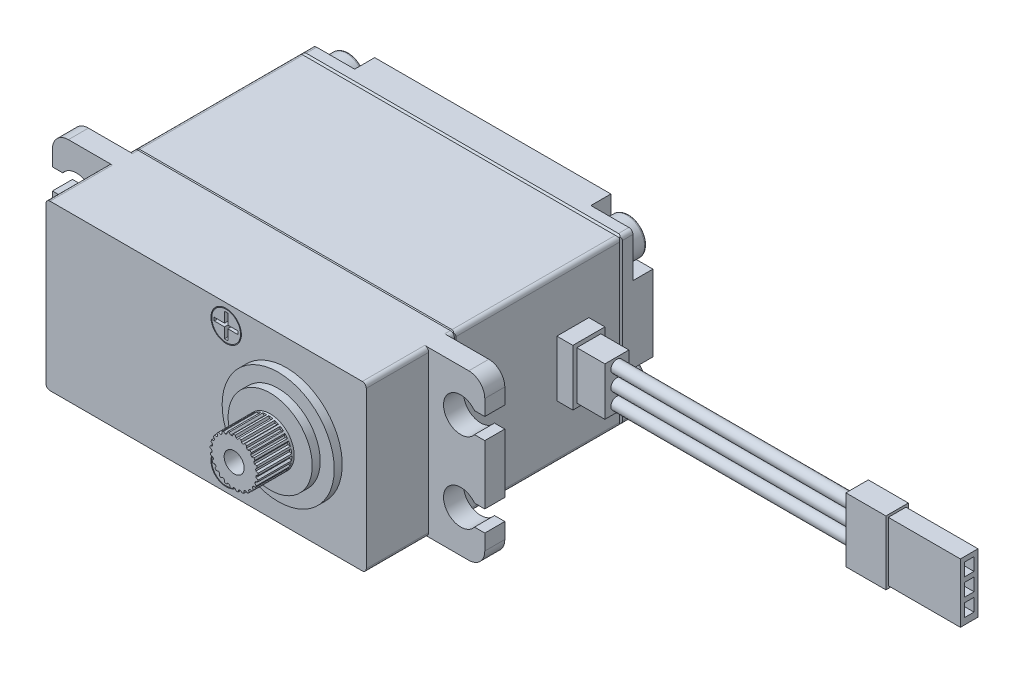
SolidWorks part; units mm, degrees
ref_plane "前视基准面" through (0, 0, 0) normal (0, 0, 1) x (1, 0, 0)
ref_plane "上视基准面" through (0, 0, 0) normal (0, 1, 0) x (1, 0, 0)
ref_plane "右视基准面" through (0, 0, 0) normal (1, 0, 0) x (0, 0, -1)
sketch "草图1" plane through (0, 0, 0) normal (0, 0, 1) x (1, 0, 0)
  line L1 (-20, 10.25) -> (20, 10.25)
  line L2 (-20, 10.25) -> (-20, -10.25)
  line L3 (-20, -10.25) -> (20, -10.25)
  line L4 (20, 10.25) -> (20, -10.25)
  dimension "D1" = 10.25
  dimension "D2" = 20.5
  dimension "D3" = 20
  dimension "D4" = 40
extrude "凸台-拉伸1" add sketch "草图1" along normal blind 4
chamfer "倒角1" distance 0.2 angle 45 4 edges at (0, 10.25, 4) (20, 0, 4) (0, -10.25, 4) (-20, 0, 4)
sketch "草图2" plane through (0, 0, 4) normal (0, 0, 1) x (1, 0, 0)
  line L0 (20, 10.25) -> (20, -10.25) construction
  line L1 (20, -10.25) -> (-20, -10.25) construction
  line L2 (-20, -10.25) -> (-20, 10.25) construction
  line L3 (-20, 10.25) -> (20, 10.25) construction
  line L4 (20, 10.25) -> (20, -10.25)
  line L5 (20, -10.25) -> (-20, -10.25)
  line L6 (-20, -10.25) -> (-20, 10.25)
  line L7 (-20, 10.25) -> (20, 10.25)
extrude "凸台-拉伸2" add sketch "草图2" along normal blind 20.8
chamfer "倒角4" distance 0.2 angle 45 4 edges at (-20, 0, 4) (0, 10.25, 4) (20, 0, 4) (0, -10.25, 4)
chamfer "倒角5" distance 0.2 angle 45 4 edges at (20, 0, 24.8) (0, -10.25, 24.8) (-20, 0, 24.8) (0, 10.25, 24.8)
sketch "草图3" plane through (0, 0, 24.8) normal (0, 0, 1) x (1, 0, 0)
  line L0 (20, 10.25) -> (20, -10.25) construction
  line L1 (20, -10.25) -> (-20, -10.25) construction
  line L2 (-20, -10.25) -> (-20, 10.25) construction
  line L3 (-20, 10.25) -> (20, 10.25) construction
  line L4 (20, 10.25) -> (20, -10.25)
  line L5 (20, -10.25) -> (-20, -10.25)
  line L6 (-20, -10.25) -> (-20, 10.25)
  line L7 (-20, 10.25) -> (20, 10.25)
extrude "凸台-拉伸3" add sketch "草图3" along normal blind 11
sketch "草图4" plane through (0, 0, 35.8) normal (0, 0, 1) x (1, 0, 0)
  line L0 (20, -10.25) -> (20, 10.25) construction
  circle A0 centre (10, 0) radius 7
  dimension "D1" = 10
  dimension "D2" = 14
extrude "凸台-拉伸4" add sketch "草图4" along normal blind 2
sketch "草图5" plane through (0, 0, 37.8) normal (0, 0, 1) x (1, 0, 0)
  circle A0 centre (10, 0) radius 3
  dimension "D1" = 6
extrude "凸台-拉伸5" add sketch "草图5" along normal blind 4.5
ref_plane "基准面1" through (0, 0, 23) normal (0, 0, 1) x (1, 0, 0)
sketch "草图11" plane through (0, 0, 42.3) normal (0, 0, 1) x (1, 0, 0)
  circle A0 centre (10, 0) radius 1.25
  dimension "D1" = 2.5
extrude "切除-拉伸7" cut sketch "草图11" against normal blind 6
sketch "草图12" plane through (0, 0, 42.3) normal (0, 0, 1) x (1, 0, 0)
  line L1 (9.76, 2.7395) -> (9.88, 2.9976)
  line L2 (10.24, 2.7395) -> (10.12, 2.9976)
  line L3 (10.9137, 2.5938) -> (10.8617, 2.8736)
  line L4 (10.4488, 2.7131) -> (10.6292, 2.9333)
  line L5 (11.5301, 2.285) -> (11.5493, 2.569)
  line L6 (11.1095, 2.5163) -> (11.3389, 2.6846)
  line L7 (12.0503, 1.8327) -> (12.1395, 2.103)
  line L8 (11.7004, 2.1613) -> (11.9645, 2.2673)
  line L9 (12.4416, 1.2653) -> (12.5953, 1.5049)
  line L10 (12.1844, 1.6705) -> (12.4667, 1.7075)
  line L11 (12.6796, 0.6183) -> (12.888, 0.8122)
  line L12 (12.5313, 1.0748) -> (12.8138, 1.0404)
  line L13 (12.7492, -0.0675) -> (12.9992, 0.0685)
  line L14 (12.719, 0.4115) -> (12.9841, 0.308)
  line L15 (12.646, -0.7491) -> (12.922, -0.6796)
  line L16 (12.736, -0.2776) -> (12.967, -0.4438)
  line L17 (12.3766, -1.3836) -> (12.6612, -1.3849)
  line L18 (12.581, -0.9493) -> (12.7634, -1.1677)
  line L19 (11.9578, -1.9312) -> (12.2332, -2.0032)
  line L20 (12.2638, -1.5613) -> (12.3862, -1.8183)
  line L21 (11.4161, -2.3574) -> (11.6649, -2.4956)
  line L22 (11.8044, -2.0752) -> (11.859, -2.3546)
  line L23 (10.7853, -2.6355) -> (10.9919, -2.8313)
  line L24 (11.2316, -2.4588) -> (11.2151, -2.7429)
  line L25 (10.1052, -2.748) -> (10.2566, -2.989)
  line L26 (10.5815, -2.6878) -> (10.4948, -2.9589)
  line L27 (9.4185, -2.6878) -> (9.5052, -2.9589)
  line L28 (9.8948, -2.748) -> (9.7434, -2.989)
  line L29 (8.7684, -2.4588) -> (8.7849, -2.7429)
  line L30 (9.2147, -2.6355) -> (9.0081, -2.8313)
  line L31 (8.1956, -2.0752) -> (8.141, -2.3546)
  line L32 (8.5839, -2.3574) -> (8.3351, -2.4956)
  line L33 (7.7362, -1.5613) -> (7.6138, -1.8183)
  line L34 (8.0422, -1.9312) -> (7.7668, -2.0032)
  line L35 (7.419, -0.9493) -> (7.2366, -1.1677)
  line L36 (7.6234, -1.3836) -> (7.3388, -1.3849)
  line L37 (7.264, -0.2776) -> (7.033, -0.4438)
  line L38 (7.354, -0.7491) -> (7.078, -0.6796)
  line L39 (7.281, 0.4115) -> (7.0159, 0.308)
  line L40 (7.2508, -0.0675) -> (7.0008, 0.0685)
  line L41 (7.4687, 1.0748) -> (7.1862, 1.0404)
  line L42 (7.3204, 0.6183) -> (7.112, 0.8122)
  line L43 (7.8156, 1.6705) -> (7.5333, 1.7075)
  line L44 (7.5584, 1.2653) -> (7.4047, 1.5049)
  line L45 (8.2996, 2.1613) -> (8.0355, 2.2673)
  line L46 (7.9497, 1.8327) -> (7.8605, 2.103)
  line L47 (8.8905, 2.5163) -> (8.6611, 2.6846)
  line L48 (8.4699, 2.285) -> (8.4507, 2.569)
  line L49 (9.5512, 2.7131) -> (9.3708, 2.9333)
  line L50 (9.0863, 2.5938) -> (9.1383, 2.8736)
  arc A0 (9.76, 2.7395) -> (9.5512, 2.7131) centre (10, 0) ccw
  arc A1 (9.0863, 2.5938) -> (8.8905, 2.5163) centre (10, 0) ccw
  circle A2 centre (10, 0) radius 3 construction
  arc A3 (9.88, 2.9976) -> (9.3708, 2.9333) centre (10, 0) ccw
  arc A4 (9.1383, 2.8736) -> (8.6611, 2.6846) centre (10, 0) ccw
  arc A5 (8.4699, 2.285) -> (8.2996, 2.1613) centre (10, 0) ccw
  arc A6 (8.4507, 2.569) -> (8.0355, 2.2673) centre (10, 0) ccw
  arc A7 (7.9497, 1.8327) -> (7.8156, 1.6705) centre (10, 0) ccw
  arc A8 (7.8605, 2.103) -> (7.5333, 1.7075) centre (10, 0) ccw
  arc A9 (7.5584, 1.2653) -> (7.4687, 1.0748) centre (10, 0) ccw
  arc A10 (7.4047, 1.5049) -> (7.1862, 1.0404) centre (10, 0) ccw
  arc A11 (7.3204, 0.6183) -> (7.281, 0.4115) centre (10, 0) ccw
  arc A12 (7.112, 0.8122) -> (7.0159, 0.308) centre (10, 0) ccw
  arc A13 (7.2508, -0.0675) -> (7.264, -0.2776) centre (10, 0) ccw
  arc A14 (7.0008, 0.0685) -> (7.033, -0.4438) centre (10, 0) ccw
  arc A15 (7.354, -0.7491) -> (7.419, -0.9493) centre (10, 0) ccw
  arc A16 (7.078, -0.6796) -> (7.2366, -1.1677) centre (10, 0) ccw
  arc A17 (7.3388, -1.3849) -> (7.6138, -1.8183) centre (10, 0) ccw
  arc A18 (7.6234, -1.3836) -> (7.7362, -1.5613) centre (10, 0) ccw
  arc A19 (8.0422, -1.9312) -> (8.1956, -2.0752) centre (10, 0) ccw
  arc A20 (7.7668, -2.0032) -> (8.141, -2.3546) centre (10, 0) ccw
  arc A21 (8.5839, -2.3574) -> (8.7684, -2.4588) centre (10, 0) ccw
  arc A22 (8.3351, -2.4956) -> (8.7849, -2.7429) centre (10, 0) ccw
  arc A23 (9.2147, -2.6355) -> (9.4185, -2.6878) centre (10, 0) ccw
  arc A24 (9.0081, -2.8313) -> (9.5052, -2.9589) centre (10, 0) ccw
  arc A25 (9.8948, -2.748) -> (10.1052, -2.748) centre (10, 0) ccw
  arc A26 (9.7434, -2.989) -> (10.2566, -2.989) centre (10, 0) ccw
  arc A27 (10.5815, -2.6878) -> (10.7853, -2.6355) centre (10, 0) ccw
  arc A28 (10.4948, -2.9589) -> (10.9919, -2.8313) centre (10, 0) ccw
  arc A29 (11.2316, -2.4588) -> (11.4161, -2.3574) centre (10, 0) ccw
  arc A30 (11.2151, -2.7429) -> (11.6649, -2.4956) centre (10, 0) ccw
  arc A31 (11.8044, -2.0752) -> (11.9578, -1.9312) centre (10, 0) ccw
  arc A32 (11.859, -2.3546) -> (12.2332, -2.0032) centre (10, 0) ccw
  arc A33 (12.3862, -1.8183) -> (12.6612, -1.3849) centre (10, 0) ccw
  arc A34 (12.2638, -1.5613) -> (12.3766, -1.3836) centre (10, 0) ccw
  arc A35 (12.7634, -1.1677) -> (12.922, -0.6796) centre (10, 0) ccw
  arc A36 (12.581, -0.9493) -> (12.646, -0.7491) centre (10, 0) ccw
  arc A37 (12.967, -0.4438) -> (12.9992, 0.0685) centre (10, 0) ccw
  arc A38 (12.736, -0.2776) -> (12.7492, -0.0675) centre (10, 0) ccw
  arc A39 (12.9841, 0.308) -> (12.888, 0.8122) centre (10, 0) ccw
  arc A40 (12.719, 0.4115) -> (12.6796, 0.6183) centre (10, 0) ccw
  arc A41 (12.5313, 1.0748) -> (12.4416, 1.2653) centre (10, 0) ccw
  arc A42 (12.8138, 1.0404) -> (12.5953, 1.5049) centre (10, 0) ccw
  arc A43 (12.1844, 1.6705) -> (12.0503, 1.8327) centre (10, 0) ccw
  arc A44 (12.4667, 1.7075) -> (12.1395, 2.103) centre (10, 0) ccw
  arc A45 (11.7004, 2.1613) -> (11.5301, 2.285) centre (10, 0) ccw
  arc A46 (11.9645, 2.2673) -> (11.5493, 2.569) centre (10, 0) ccw
  arc A47 (11.1095, 2.5163) -> (10.9137, 2.5938) centre (10, 0) ccw
  arc A48 (11.3389, 2.6846) -> (10.8617, 2.8736) centre (10, 0) ccw
  arc A49 (10.4488, 2.7131) -> (10.24, 2.7395) centre (10, 0) ccw
  arc A50 (10.6292, 2.9333) -> (10.12, 2.9976) centre (10, 0) ccw
  point P111 (10, 0)
  dimension "D1" = 5.5
  dimension "D4" = 25
extrude "切除-拉伸8" cut sketch "草图12" against normal blind 4.2
sketch "草图17" plane through (20, 0, 0) normal (1, 0, 0) x (0, 0, -1)
  line L2 (-12, 3.5) -> (-8, 3.5)
  line L3 (-12, 3.5) -> (-12, -3.5)
  line L4 (-12, -3.5) -> (-8, -3.5)
  line L5 (-8, 3.5) -> (-8, -3.5)
  dimension "D2" = 7
  dimension "D3" = 3.5
  dimension "D4" = 4
extrude "凸台-拉伸8" add sketch "草图17" along normal blind 2
sketch "草图18" plane through (22, 0, 0) normal (1, 0, 0) x (0, 0, -1)
  line L8 (-11.5, 3) -> (-11.5, -3)
  line L9 (-11.5, -3) -> (-8.5, -3)
  line L10 (-8.5, -3) -> (-8.5, 3)
  line L11 (-8.5, 3) -> (-11.5, 3)
  line L12 (-11.5, 3) -> (-11.5, -3)
  line L13 (-11.5, -3) -> (-8.5, -3)
  line L14 (-8.5, -3) -> (-8.5, 3)
  line L15 (-8.5, 3) -> (-11.5, 3)
  dimension "D1" = 0.5
extrude "凸台-拉伸9" add sketch "草图18" along normal blind 3.5
sketch "草图19" plane through (25.5, 0, 0) normal (1, 0, 0) x (0, 0, -1)
  line L0 (-8.5, -3) -> (-8.5, 3) construction
  line L1 (-8.5, -3) -> (-8.5, 3) construction
  line L2 (-8.5, 3) -> (-11.5, 3) construction
  circle A0 centre (-10, 0) radius 0.75
  circle A1 centre (-10, 2) radius 0.75
  circle A2 centre (-10, -2) radius 0.75
  dimension "D1" = 1.5
  dimension "D2" = 1.5
  dimension "D3" = 1.5
  dimension "D4" = 1.5
  dimension "D5" = 1.5
  dimension "D6" = 1.5
  dimension "D7" = 1
  dimension "D8" = 2
  dimension "D9" = 2
extrude "凸台-拉伸10" add sketch "草图19" along normal blind 30
sketch "草图20" plane through (55.5, 0, 0) normal (1, 0, 0) x (0, 0, -1)
  line L1 (-11.4, 4) -> (-8.6, 4)
  line L2 (-11.4, 4) -> (-11.4, -4)
  line L3 (-11.4, -4) -> (-8.6, -4)
  line L4 (-8.6, 4) -> (-8.6, -4)
  circle A0 centre (-10, 2) radius 0.75 construction
  dimension "D1" = 8
  dimension "D2" = 2.8
  dimension "D3" = 1.4
  dimension "D4" = 4
extrude "凸台-拉伸11" add sketch "草图20" along normal blind 5
sketch "草图21" plane through (60.5, 0, 0) normal (1, 0, 0) x (0, 0, -1)
  line L5 (-10.59, 3.1) -> (-9.4, 3.1)
  line L6 (-10.59, 3.1) -> (-10.59, 1.5)
  line L7 (-10.59, 1.5) -> (-9.4, 1.5)
  line L8 (-11.1, 3.7) -> (-11.1, -3.7)
  line L9 (-11.1, -3.7) -> (-8.9, -3.7)
  line L10 (-8.9, -3.7) -> (-8.9, 3.7)
  line L11 (-8.9, 3.7) -> (-11.1, 3.7)
  line L12 (-11.1, 3.7) -> (-11.1, -3.7)
  line L13 (-11.1, -3.7) -> (-8.9, -3.7)
  line L14 (-8.9, -3.7) -> (-8.9, 3.7)
  line L15 (-8.9, 3.7) -> (-11.1, 3.7)
  line L16 (-9.4, 3.1) -> (-9.4, 1.5)
  line L17 (-10.59, 0.9) -> (-9.4, 0.9)
  line L18 (-10.59, 0.9) -> (-10.59, -0.7)
  line L19 (-10.59, -0.7) -> (-9.4, -0.7)
  line L20 (-9.4, 0.9) -> (-9.4, -0.7)
  line L21 (-10.59, -1.3) -> (-9.4, -1.3)
  line L22 (-10.59, -1.3) -> (-10.59, -2.9)
  line L23 (-10.59, -2.9) -> (-9.4, -2.9)
  line L24 (-9.4, -1.3) -> (-9.4, -2.9)
  dimension "D2" = 1.6
  dimension "D3" = 1.6
  dimension "D4" = 1.6
  dimension "D5" = 0.5
  dimension "D6" = 0.5
  dimension "D7" = 0.5
  dimension "D8" = 0.6
  dimension "D9" = 0.6
  dimension "D10" = 0.6
  dimension "D1" = 0.3
extrude "凸台-拉伸12" add sketch "草图21" along normal blind 9
sketch "草图22" plane through (0, 0, 0) normal (0, 0, -1) x (-1, 0, 0)
  line L5 (-20, 4.75) -> (-20, 10.25)
  line L6 (-20, 10.25) -> (-14.75, 10.25)
  line L7 (-17.5, -4.75) -> (-20, -4.75)
  line L8 (-14.75, -7.5) -> (-14.75, -10.25)
  line L9 (-20, -4.75) -> (-20, -10.25)
  line L11 (-20, -10.25) -> (-14.75, -10.25)
  line L12 (-14.75, 7.5) -> (-14.75, 10.25)
  line L13 (-17.5, 4.75) -> (-20, 4.75)
  line L14 (14.75, -7.5) -> (14.75, -10.25)
  line L15 (20, -10.25) -> (14.75, -10.25)
  line L16 (20, -4.75) -> (20, -10.25)
  line L17 (17.5, -4.75) -> (20, -4.75)
  line L18 (20, 4.75) -> (20, 10.25)
  line L19 (17.5, 4.75) -> (20, 4.75)
  line L20 (14.75, 7.5) -> (14.75, 10.25)
  line L21 (20, 10.25) -> (14.75, 10.25)
  arc A0 (-14.75, -7.5) -> (-17.5, -4.75) centre (-17.5, -7.5) ccw
  arc A1 (-14.75, 7.5) -> (-17.5, 4.75) centre (-17.5, 7.5) cw
  arc A2 (14.75, -7.5) -> (17.5, -4.75) centre (17.5, -7.5) cw
  arc A3 (14.75, 7.5) -> (17.5, 4.75) centre (17.5, 7.5) ccw
  dimension "D3" = 5.5
extrude "切除-拉伸13" cut sketch "草图22" against normal blind 2.5
sketch "草图23" plane through (0, 0, 2.5) normal (0, 0, -1) x (-1, 0, 0)
  line L4 (-17.25, -7.75) -> (-15.6165, -7.75)
  line L5 (-17.25, -7.25) -> (-15.6165, -7.25)
  line L6 (-17.25, 7.25) -> (-17.25, 5.6165)
  line L7 (-17.25, 7.75) -> (-15.6165, 7.75)
  line L8 (-17.25, -7.25) -> (-17.25, -5.6165)
  line L9 (-17.75, 7.25) -> (-17.75, 5.6165)
  line L10 (-17.75, -7.25) -> (-17.75, -5.6165)
  line L11 (-17.25, 7.25) -> (-15.6165, 7.25)
  line L12 (-19.3835, -7.25) -> (-17.75, -7.25)
  line L13 (-19.3835, -7.75) -> (-17.75, -7.75)
  line L14 (-17.75, -9.3835) -> (-17.75, -7.75)
  line L15 (-17.25, -9.3835) -> (-17.25, -7.75)
  line L16 (-19.3835, 7.25) -> (-17.75, 7.25)
  line L17 (-19.3835, 7.75) -> (-17.75, 7.75)
  line L18 (-17.25, 9.3835) -> (-17.25, 7.75)
  line L19 (-17.75, 9.3835) -> (-17.75, 7.75)
  line L20 (17.25, -7.25) -> (15.6165, -7.25)
  line L21 (17.25, -7.75) -> (15.6165, -7.75)
  line L22 (17.25, -9.3835) -> (17.25, -7.75)
  line L23 (17.75, -9.3835) -> (17.75, -7.75)
  line L24 (19.3835, -7.75) -> (17.75, -7.75)
  line L25 (19.3835, -7.25) -> (17.75, -7.25)
  line L26 (17.75, -7.25) -> (17.75, -5.6165)
  line L27 (17.25, -7.25) -> (17.25, -5.6165)
  line L28 (19.3835, 7.25) -> (17.75, 7.25)
  line L29 (17.75, 7.25) -> (17.75, 5.6165)
  line L30 (17.25, 7.25) -> (17.25, 5.6165)
  line L31 (17.25, 7.25) -> (15.6165, 7.25)
  line L32 (17.25, 7.75) -> (15.6165, 7.75)
  line L33 (17.25, 9.3835) -> (17.25, 7.75)
  line L34 (17.75, 9.3835) -> (17.75, 7.75)
  line L35 (19.3835, 7.75) -> (17.75, 7.75)
  circle A0 centre (-17.5, 7.5) radius 2.25
  arc A1 (-15.6165, 7.25) -> (-15.6165, 7.75) centre (-17.5, 7.5) ccw
  arc A2 (-17.75, 5.6165) -> (-17.25, 5.6165) centre (-17.5, 7.5) ccw
  arc A3 (-19.3835, 7.75) -> (-19.3835, 7.25) centre (-17.5, 7.5) ccw
  arc A4 (-17.25, 9.3835) -> (-17.75, 9.3835) centre (-17.5, 7.5) ccw
  arc A5 (-17.75, -5.6165) -> (-17.25, -5.6165) centre (-17.5, -7.5) cw
  arc A6 (-15.6165, -7.25) -> (-15.6165, -7.75) centre (-17.5, -7.5) cw
  arc A7 (-19.3835, -7.75) -> (-19.3835, -7.25) centre (-17.5, -7.5) cw
  arc A8 (-17.25, -9.3835) -> (-17.75, -9.3835) centre (-17.5, -7.5) cw
  circle A9 centre (-17.5, -7.5) radius 2.25
  arc A10 (15.6165, -7.25) -> (15.6165, -7.75) centre (17.5, -7.5) ccw
  arc A11 (17.25, -9.3835) -> (17.75, -9.3835) centre (17.5, -7.5) ccw
  arc A12 (19.3835, -7.75) -> (19.3835, -7.25) centre (17.5, -7.5) ccw
  arc A13 (17.75, -5.6165) -> (17.25, -5.6165) centre (17.5, -7.5) ccw
  circle A14 centre (17.5, -7.5) radius 2.25
  arc A15 (17.75, 5.6165) -> (17.25, 5.6165) centre (17.5, 7.5) cw
  arc A16 (19.3835, 7.75) -> (19.3835, 7.25) centre (17.5, 7.5) cw
  arc A17 (15.6165, 7.25) -> (15.6165, 7.75) centre (17.5, 7.5) cw
  arc A18 (17.25, 9.3835) -> (17.75, 9.3835) centre (17.5, 7.5) cw
  circle A19 centre (17.5, 7.5) radius 2.25
  point P8 (-19.75, 7.25)
  point P9 (-13.9428, 7.25)
  point P10 (-17.75, 9.75)
  point P11 (-17.75, 5.25)
  point P12 (-19.75, 7.75)
  point P13 (-13.9428, 7.75)
  point P14 (-17.25, 9.75)
  point P15 (-17.25, 5.25)
  dimension "D1" = 4.5
  dimension "D2" = 3.8
extrude "凸台-拉伸13" add sketch "草图23" along normal blind 2
fillet "圆角2" radius 0.3 4 edges at (-19.75, -7.5, 0.5) (19.75, -7.5, 0.5) (15.25, 7.5, 0.5) (-15.25, 7.5, 0.5)
chamfer "倒角6" distance 0.5 angle 45 1 edges at (17, 0, 37.8)
fillet "圆角6" radius 0.5 4 edges at (20, 10.25, 30.3) (20, -10.25, 30.3) (-20, 10.25, 30.3) (-20, -10.25, 30.3)
fillet "圆角7" radius 0.5 4 edges at (20, -10.25, 14.4) (20, 10.25, 14.4) (-20, 10.25, 14.4) (-20, -10.25, 14.4)
fillet "圆角8" radius 0.5 4 edges at (20, 10.25, 3.15) (-20, 10.25, 3.15) (-20, -10.25, 3.15) (20, -10.25, 3.15)
sketch "草图24" plane through (0, 0, 37.8) normal (0, 0, 1) x (1, 0, 0)
  circle A0 centre (10, 0) radius 5.25
  circle A3 centre (10, 0) radius 7 construction
  circle A4 centre (10, 0) radius 7
  dimension "D1" = 10.5
extrude "切除-拉伸14" cut sketch "草图24" against normal blind 1
ref_plane "基准面2" through (0, 0, 25.5) normal (0, 0, -1) x (-1, 0, 0)
sketch "草图25" plane through (0, 0, 25.5) normal (0, 0, -1) x (-1, 0, 0)
  line L5 (27, 10.25) -> (27, 6.3)
  line L6 (19.5, 10.25) -> (27, 10.25)
  line L8 (19.5, -10.25) -> (27, -10.25)
  line L10 (20, 4.75) -> (20, 9.75) construction
  line L11 (20, 4.75) -> (20, 9.75)
  line L12 (20, 9.75) -> (20, -9.75)
  line L13 (25.7125, -3.7) -> (27, -3.7)
  line L15 (25.7125, 3.7) -> (27, 3.7)
  line L16 (25.7125, 6.3) -> (27, 6.3)
  line L17 (27, 3.7) -> (27, -3.7)
  line L18 (25.7125, -6.3) -> (27, -6.3)
  line L19 (27, -6.3) -> (27, -10.25)
  line L20 (-27, -6.3) -> (-27, -10.25)
  line L21 (-25.7125, -6.3) -> (-27, -6.3)
  line L22 (-27, 3.7) -> (-27, -3.7)
  line L23 (-25.7125, 6.3) -> (-27, 6.3)
  line L24 (-25.7125, 3.7) -> (-27, 3.7)
  line L25 (-25.7125, -3.7) -> (-27, -3.7)
  line L26 (-20, 9.75) -> (-20, -9.75)
  line L27 (-20, 4.75) -> (-20, 9.75)
  line L28 (-19.5, -10.25) -> (-27, -10.25)
  line L29 (-19.5, 10.25) -> (-27, 10.25)
  line L30 (-27, 10.25) -> (-27, 6.3)
  arc A0 (20, 9.75) -> (19.5, 10.25) centre (19.5, 9.75) ccw construction
  arc A1 (20, 9.75) -> (19.5, 10.25) centre (19.5, 9.75) ccw
  arc A2 (19.5, -10.25) -> (20, -9.75) centre (19.5, -9.75) ccw construction
  arc A3 (19.5, -10.25) -> (20, -9.75) centre (19.5, -9.75) ccw
  arc A4 (25.7125, 6.3) -> (25.7125, 3.7) centre (24, 5) ccw
  arc A5 (25.7125, -6.3) -> (25.7125, -3.7) centre (24, -5) cw
  arc A6 (-25.7125, -6.3) -> (-25.7125, -3.7) centre (-24, -5) ccw
  arc A7 (-25.7125, 6.3) -> (-25.7125, 3.7) centre (-24, 5) cw
  arc A8 (-19.5, -10.25) -> (-20, -9.75) centre (-19.5, -9.75) cw
  arc A9 (-20, 9.75) -> (-19.5, 10.25) centre (-19.5, 9.75) cw
  point P12 (27, -12.95)
  point P18 (24, 3.7)
  point P20 (29.0926, 3.7)
  point P28 (24, 6.3)
  point P29 (29.0926, 6.3)
extrude "凸台-拉伸14" add sketch "草图25" against normal blind 2.5 contours L18 A5 L13 L17 L15 A4 L16 L5 L6 A1 L11 L12 A3 L8 L19 | L26 A9 L29 L30 L23 A7 L24 L22 L25 A6 L21 L20 L28 A8
fillet "圆角9" radius 2 4 edges at (-27, 10.25, 26.75) (27, 10.25, 26.75) (27, -10.25, 26.75) (-27, -10.25, 26.75)
sketch "草图26" plane through (0, 0, 35.8) normal (0, 0, 1) x (1, 0, 0)
  line L0 (19.5, 10.25) -> (-19.5, 10.25) construction
  circle A3 centre (2.5, 7.75) radius 1.9
  circle A4 centre (2.5, -7.75) radius 1.9
  dimension "D1" = 3.8
  dimension "D2" = 2.5
extrude "切除-拉伸15" cut sketch "草图26" against normal blind 1.3
sketch "草图27" plane through (0, 0, 34.5) normal (0, 0, 1) x (1, 0, 0)
  line L10 (2.7, 7.95) -> (3.9866, 7.95)
  line L12 (2.3, 7.95) -> (2.3, 9.2366)
  line L14 (2.7, 7.55) -> (3.9866, 7.55)
  line L16 (2.7, 7.95) -> (2.7, 9.2366)
  line L17 (2.7, 6.2634) -> (2.7, 7.55)
  line L18 (1.0134, 7.55) -> (2.3, 7.55)
  line L19 (2.3, 6.2634) -> (2.3, 7.55)
  line L20 (1.0134, 7.95) -> (2.3, 7.95)
  arc A8 (1.0134, 7.55) -> (1.0134, 7.95) centre (2.5, 7.75) cw
  arc A9 (2.3, 9.2366) -> (2.7, 9.2366) centre (2.5, 7.75) cw
  arc A10 (3.9866, 7.95) -> (3.9866, 7.55) centre (2.5, 7.75) cw
  arc A11 (2.7, 6.2634) -> (2.3, 6.2634) centre (2.5, 7.75) cw
  circle A13 centre (2.5, 7.75) radius 1.8
  point P12 (1, -7.95)
  point P13 (4.4, -7.95)
  point P14 (2.3, -6.25)
  point P15 (2.3, -9.3797)
  point P16 (1, -7.55)
  point P17 (4.4, -7.55)
  point P18 (2.7, -6.25)
  point P19 (2.7, -9.3797)
extrude "凸台-拉伸16" add sketch "草图27" along normal blind 1.3 contours A13 L17 A11 L19 L18 A8 L20 L12 A9 L16 L10 A10 L14
mirror "镜向1" about plane through (0, 0, 0) normal (0, 1, 0) of "凸台-拉伸16"
